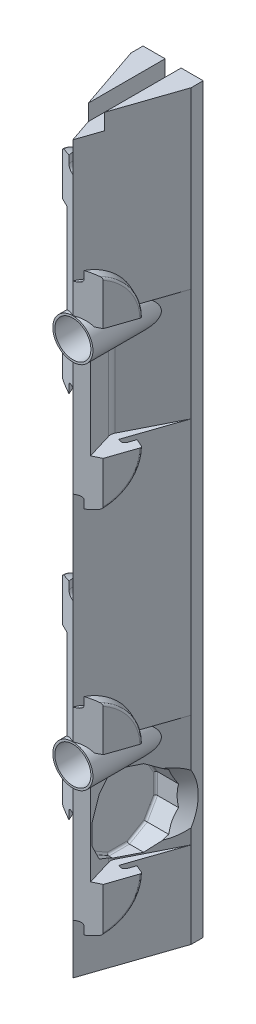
SolidWorks part; units mm, degrees
ref_plane "Plan de face" through (0, 0, 0) normal (0, 0, 1) x (1, 0, 0)
ref_plane "Plan de dessus" through (0, 0, 0) normal (0, 1, 0) x (1, 0, 0)
ref_plane "Plan de droite" through (0, 0, 0) normal (1, 0, 0) x (0, 0, -1)
body saved out of another part "Stock-hautBarette-1"
sketch "Esquisse1" plane through (0, 0, -3) normal (0, 0, -1) x (-1, 0, 0)
  line L0 (7.5, -303.9983) -> (22.5, -303.9983) construction
  line L1 (13, -303.9983) -> (17, -303.9983)
  line L2 (13, -303.9983) -> (13, -307.9983)
  line L3 (13, -307.9983) -> (17, -307.9983)
  line L4 (17, -303.9983) -> (17, -307.9983)
  line L5 (7.5, -303.9983) -> (7.5, -489) construction
  point P6 (15, -307.9983)
  dimension "D1" = 4
  dimension "D2" = 4
  dimension "D3" = 7.5
extrude "Enlèv. mat.-Extru.1" cut sketch "Esquisse1" against normal through all
sketch "Esquisse2" plane through (0, 0, -3) normal (0, 0, -1) x (-1, 0, 0)
  line B0 (11.3691, -313.0134) -> (11.3691, -344.3683) construction
sketch_block_instance "Bloc1-1"
sketch_block "Bloc1"
extrude "Enlèv. mat.-Extru.2" cut sketch "Esquisse2" against normal blind 1.5
